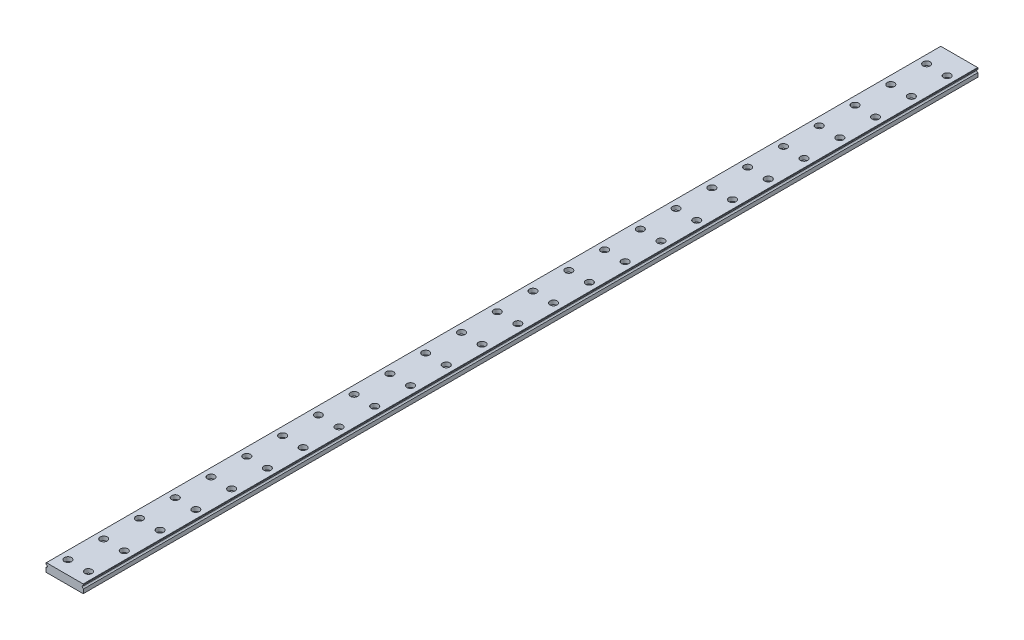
SolidWorks part; units mm, degrees
ref_plane "Front Plane" through (0, 0, 0) normal (0, 0, 1) x (1, 0, 0)
ref_plane "Top Plane" through (0, 0, 0) normal (0, 1, 0) x (1, 0, 0)
ref_plane "Right Plane" through (0, 0, 0) normal (1, 0, 0) x (0, 0, -1)
sketch "Sketch2" plane through (0, 0, 0) normal (0, 0, 1) x (1, 0, 0)
  line L0 (11.1968, -4.8311) -> (20.9968, -4.8311)
  line L1 (20.9968, -4.8311) -> (21.3968, -4.4311)
  line L2 (21.3968, -4.4311) -> (21.3968, 0.0689)
  line L3 (21.3968, 3.0689) -> (21.3968, 4.2689)
  line L4 (21.3968, 4.2689) -> (20.9968, 4.6689)
  line L5 (20.9968, 4.6689) -> (-20.2032, 4.6689)
  line L6 (-20.2032, 4.6689) -> (-20.6032, 4.2689)
  line L7 (-20.6032, 4.2689) -> (-20.6032, 3.0689)
  line L8 (-20.6032, 0.0689) -> (-20.6032, -4.4311)
  line L9 (-20.6032, -4.4311) -> (-20.2032, -4.8311)
  line L10 (-20.2032, -4.8311) -> (10.5968, -4.8311)
  line L11 (10.5968, -4.8311) -> (11.1968, -4.8311)
  arc A0 (19.8968, 1.5689) -> (21.3968, 0.0689) centre (21.3968, 1.5689) ccw
  arc A1 (21.3968, 3.0689) -> (19.8968, 1.5689) centre (21.3968, 1.5689) ccw
  arc A2 (-20.6032, 0.0689) -> (-20.6032, 3.0689) centre (-20.6032, 1.5689) ccw
extrude "Boss-Extrude1" add sketch "Sketch2" along normal blind 1000
sketch "Sketch3" plane through (0, 4.6689, 0) normal (0, 1, 0) x (1, 0, 0)
  line L0 (21.3968, -1000) -> (21.3968, 0) construction
  line L1 (-20.6032, -1000) -> (-20.6032, 0) construction
  line L2 (20.9968, 0) -> (-20.2032, 0) construction
  point P0 (-11.1032, -15)
  point P1 (11.8968, -15)
  dimension "D1" = 9.5
  dimension "D2" = 9.5
  dimension "D3" = 15
  dimension "D4" = 15
hole_wizard "CBORE for M16 Hex Head Bolt1" positions "Sketch3" profile "Sketch4" counterbore size "M16" standard "DIN"
sketch "Sketch4" plane through (-11.1032, 4.6689, 15) normal (1, 0, 0) x (0, 0, 1)
  line L0 (0, 0) -> (0, 9.5)
  line L1 (0, 9.5) -> (2.25, 9.5)
  line L3 (2.25, 9.5) -> (2.25, 4.5)
  line L4 (2.25, 4.5) -> (4, 4.5)
  line L5 (4, 4.5) -> (4, 0)
  line L7 (4, 0) -> (0, 0)
  line L11 (0, -6.35) -> (0, 107.95) construction
  dimension "Thru Hole Dia." = 4.5
  dimension "Thru Hole Depth" = 9.5
  dimension "C'Bore Dia." = 8
  dimension "C'Bore Depth" = 4.5
other "Fill Pattern1" parameters "D5"=0, "D6"=0, "D1"=40, "D2"=60, "D3"=0, "D9"=25, "D7"=25, "D8"=2
move or copy body "Body-Move/Copy1" bodies to move or copy 104 copy no rotation origin (0.3968, 0, 500) rotation axis (0, 1, 0) rotation angle 180
